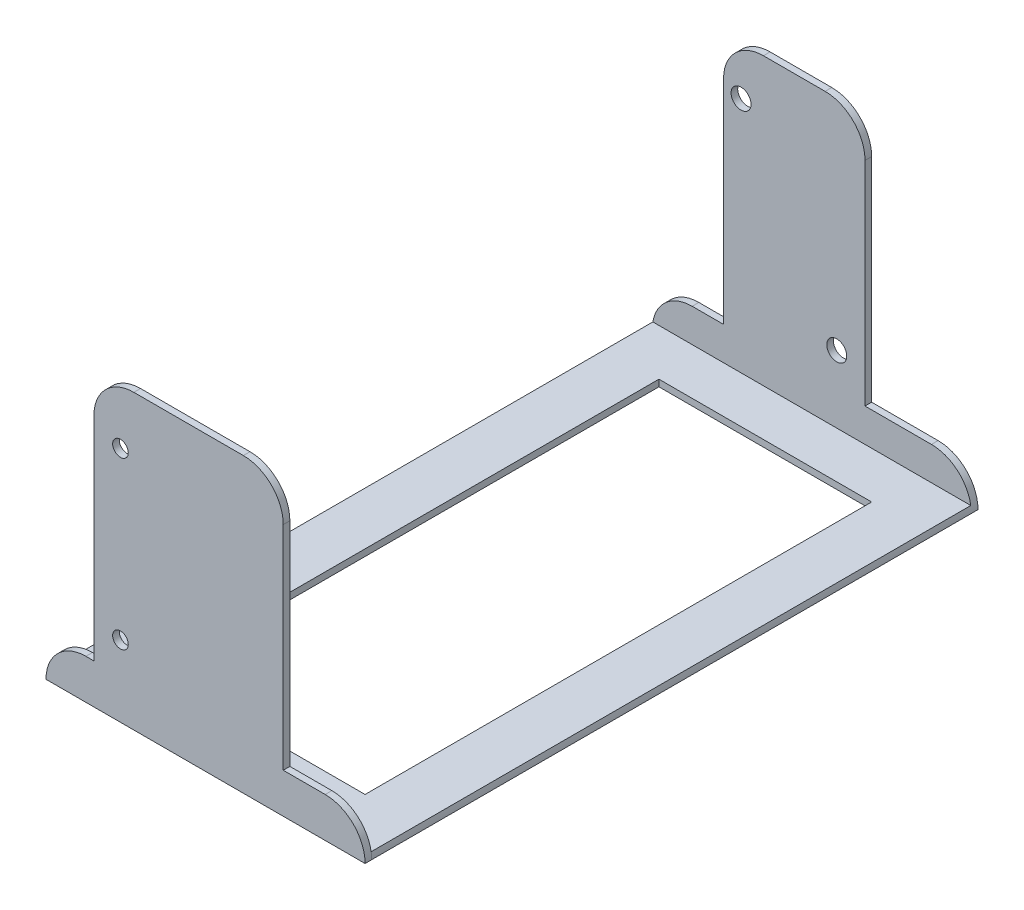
SolidWorks part; units mm, degrees
ref_plane "Front Plane" through (0, 0, 0) normal (0, 0, 1) x (1, 0, 0)
ref_plane "Top Plane" through (0, 0, 0) normal (0, 1, 0) x (1, 0, 0)
ref_plane "Right Plane" through (0, 0, 0) normal (1, 0, 0) x (0, 0, -1)
sketch "Sketch1" plane through (0, 0, 0) normal (1, 0, 0) x (0, 0, -1)
  line L0 (0, 0) -> (0, 69.85)
  line L1 (0, 69.85) -> (1.5875, 69.85)
  line L2 (1.5875, 69.85) -> (1.5875, 1.5875)
  line L3 (1.5875, 1.5875) -> (144.7927, 1.5875)
  line L4 (144.7927, 1.5875) -> (144.7927, 69.85)
  line L5 (144.7927, 69.85) -> (146.3802, 69.85)
  line L6 (146.3802, 69.85) -> (146.3802, 0)
  line L7 (146.3802, 0) -> (0, 0)
  point P3 (-22.1036, 75.1529)
  dimension "D1" = 1.5875
  dimension "D2" = 1.5875
  dimension "D3" = 1.5875
  dimension "D4" = 143.2052
  dimension "D5" = 69.85
  dimension "D6" = 69.85
extrude "Boss-Extrude1" add sketch "Sketch1" along normal blind 76.2
sketch "Sketch2" plane through (0, 0, 0) normal (0, 0, 1) x (1, 0, 0)
  line L0 (76.2, 1.5875) -> (0, 1.5875) construction
  line L1 (0, 1.5875) -> (0, 69.85) construction
  circle A0 centre (17.78, 17.0434) radius 1.8669
  circle A1 centre (17.78, 56.6674) radius 1.8669
  dimension "D1" = 3.7338
  dimension "D2" = 3.7338
  dimension "D3" = 39.624
  dimension "D4" = 15.4559
  dimension "D5" = 17.78
extrude "Cut-Extrude1" cut sketch "Sketch2" against normal up to next
sketch "Sketch3" plane through (0, 0, -144.7927) normal (0, 0, 1) x (1, 0, 0)
  line L0 (76.2, 1.5875) -> (0, 1.5875) construction
  line L1 (0, 69.85) -> (0, 1.5875) construction
  circle A0 centre (44.0563, 17.6657) radius 2.3812
  circle A1 centre (21.1963, 58.3057) radius 2.3813
  dimension "D1" = 4.7625
  dimension "D2" = 4.7625
  dimension "D5" = 40.64
  dimension "D6" = 22.86
  dimension "D3" = 16.0782
  dimension "D4" = 44.0563
extrude "Cut-Extrude2" cut sketch "Sketch3" against normal up to next
sketch "Sketch4" plane through (0, 0, 0) normal (0, -1, 0) x (1, 0, 0)
  line L0 (0, 0) -> (0, -146.3802) construction
  line L1 (12.7, -12.7) -> (63.5, -12.7)
  line L2 (12.7, -12.7) -> (12.7, -133.6802)
  line L3 (12.7, -133.6802) -> (63.5, -133.6802)
  line L4 (63.5, -12.7) -> (63.5, -133.6802)
  line L5 (76.2, 0) -> (0, 0) construction
  line L6 (76.2, 0) -> (76.2, -146.3802) construction
  line L7 (76.2, -146.3802) -> (0, -146.3802) construction
  dimension "D1" = 12.7
  dimension "D2" = 12.7
  dimension "D3" = 12.7
  dimension "D4" = 12.7
extrude "Cut-Extrude3" cut sketch "Sketch4" against normal up to next
sketch "Sketch5" plane through (0, 0, -146.3802) normal (0, 0, -1) x (-1, 0, 0)
  line L0 (-50.8, 69.85) -> (-50.8, 0) construction
  line L1 (-76.2, 69.85) -> (0, 69.85) construction
  line L2 (-76.2, 0) -> (0, 0) construction
  line L3 (-17.018, 69.85) -> (-17.018, 0) construction
  line L4 (-76.2, 0) -> (-76.2, 69.85) construction
  line L5 (0, 0) -> (0, 69.85) construction
  line L7 (-76.2, 69.85) -> (-50.8, 69.85)
  line L8 (-76.2, 69.85) -> (-76.2, 9.525)
  line L9 (-76.2, 9.525) -> (-50.8, 9.525)
  line L10 (-50.8, 69.85) -> (-50.8, 9.525)
  line L11 (0, 69.85) -> (-17.018, 69.85)
  line L12 (0, 69.85) -> (0, 9.525)
  line L13 (0, 9.525) -> (-17.018, 9.525)
  line L14 (-17.018, 69.85) -> (-17.018, 9.525)
  dimension "D1" = 25.4
  dimension "D2" = 17.018
  dimension "D3" = 9.525
  dimension "D4" = 9.525
extrude "Cut-Extrude4" cut sketch "Sketch5" against normal up to next
fillet "Fillet2" radius 9.525 4 edges at (0, 9.525, -145.5865) (17.018, 69.85, -145.5865) (50.8, 69.85, -145.5865) (76.2, 9.525, -145.5865)
sketch "Sketch6" plane through (0, 0, 0) normal (0, 0, 1) x (1, 0, 0)
  line L0 (11.4554, 69.85) -> (11.4554, 0) construction
  line L1 (76.2, 69.85) -> (0, 69.85) construction
  line L2 (76.2, 0) -> (0, 0) construction
  line L3 (56.6547, 69.85) -> (56.6547, 0) construction
  line L5 (0, 69.85) -> (0, 0) construction
  line L7 (76.2, 69.85) -> (56.6547, 69.85)
  line L8 (76.2, 69.85) -> (76.2, 9.525)
  line L9 (76.2, 9.525) -> (56.6547, 9.525)
  line L10 (56.6547, 69.85) -> (56.6547, 9.525)
  line L11 (0, 69.85) -> (11.4554, 69.85)
  line L12 (0, 69.85) -> (0, 9.525)
  line L13 (0, 9.525) -> (11.4554, 9.525)
  line L14 (11.4554, 69.85) -> (11.4554, 9.525)
  dimension "D1" = 45.1993
  dimension "D2" = 11.4554
  dimension "D3" = 9.525
  dimension "D4" = 9.525
extrude "Cut-Extrude5" cut sketch "Sketch6" against normal up to next
fillet "Fillet3" radius 9.525 4 edges at (56.6547, 69.85, -0.7937) (11.4554, 69.85, -0.7937) (0, 9.525, -0.7938) (76.2, 9.525, -0.7937)
